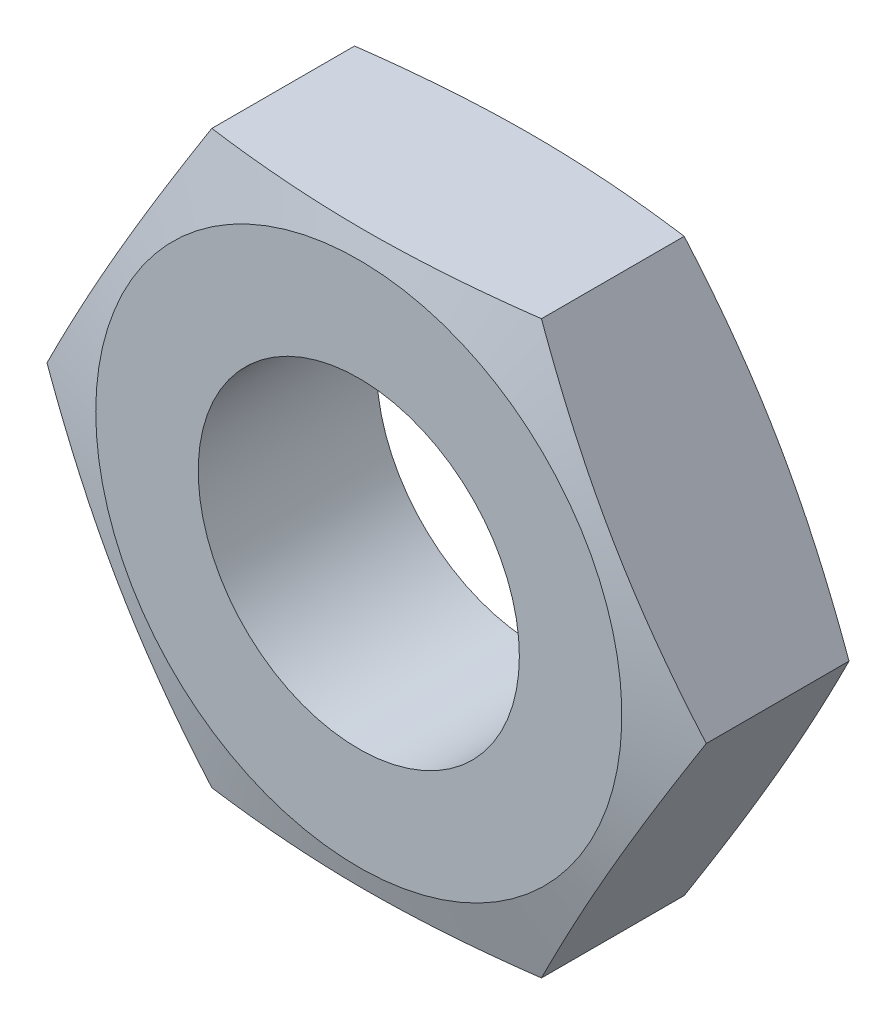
SolidWorks part; units mm, degrees
ref_plane "Plan1" through (0, 0, 0) normal (0, 0, 1) x (1, 0, 0)
ref_plane "Plan2" through (0, 0, 0) normal (0, 1, 0) x (1, 0, 0)
ref_plane "Plan3" through (0, 0, 0) normal (1, 0, 0) x (0, 0, -1)
sketch "Esquisse1" plane through (0, 0, 0) normal (0, 0, 1) x (1, 0, 0)
  line L0 (-4.6188, 8) -> (4.6188, 8)
  line L1 (4.6188, 8) -> (9.2376, 0)
  line L2 (9.2376, 0) -> (4.6188, -8)
  line L3 (4.6188, -8) -> (-4.6188, -8)
  line L4 (-4.6188, -8) -> (-9.2376, 0)
  line L5 (-9.2376, 0) -> (-4.6188, 8)
  circle A0 centre (0, 0) radius 9.2376 construction
  circle A1 centre (0, 0) radius 4.5
  dimension "D2" = 9
  dimension "D1" = 16
extrude "Base-Extrusion" add sketch "Esquisse1" along normal mid plane 5
sketch "Esquisse2" plane through (0, 0, 0) normal (0, 1, 0) x (1, 0, 0)
  line L0 (0, 4.396) -> (0, -4.8936) construction
  line L1 (0, -2.5) -> (0, 2.5) construction
  line L3 (-50, 0) -> (50, 0) construction
  line L4 (7.3716, 2.5) -> (9.2376, 2.5)
  line L5 (4.6188, 2.5) -> (9.2376, 2.5) construction
  line L6 (7.3716, 2.5) -> (9.2376, 2)
  line L7 (9.2376, -2.5) -> (9.2376, 2.5) construction
  line L11 (9.2376, 2) -> (9.2376, 2.5)
  dimension "D1" = 15
  dimension "D2" = 0.5
revolve "Enlever de la matière-Révolution1" cut sketch "Esquisse2" angle 360 about L0
sketch "Esquisse3" plane through (0, 0, 0) normal (0, 1, 0) x (1, 0, 0)
  line L0 (0, 3.467) -> (0, -3.9813) construction
  line L1 (9.2376, -2.5) -> (9.2376, 2) construction
  line L2 (9.2376, -2.5) -> (9.2376, -2)
  line L3 (9.2376, -2.5) -> (7.3716, -2.5)
  line L5 (7.3716, -2.5) -> (9.2376, -2)
  line L6 (-50, 0) -> (50, 0) construction
  line L7 (4.6188, -2.5) -> (9.2376, -2.5) construction
  dimension "D1" = 15
  dimension "D2" = 0.5
revolve "Enlever de la matière-Révolution2" cut sketch "Esquisse3" angle 360 about L0
